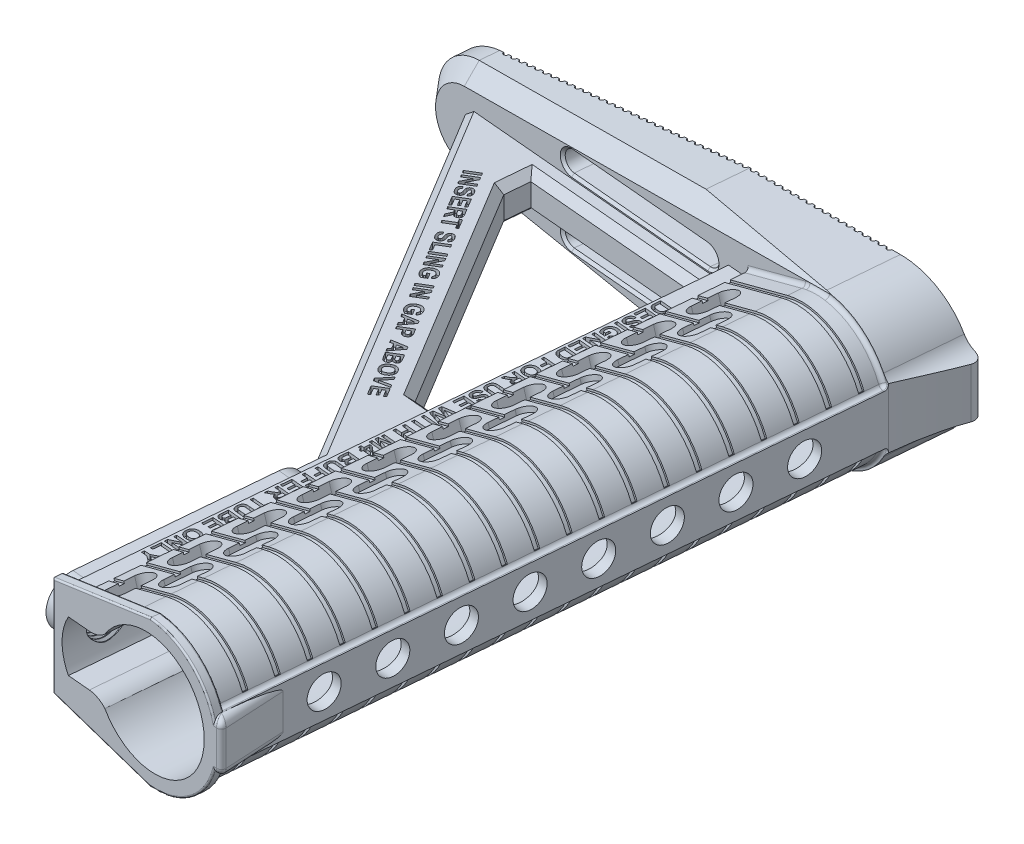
SolidWorks part; units mm, degrees
ref_plane "Front Plane" through (0, 0, 0) normal (0, 0, 1) x (1, 0, 0)
ref_plane "Top Plane" through (0, 0, 0) normal (0, 1, 0) x (1, 0, 0)
ref_plane "Right Plane" through (0, 0, 0) normal (1, 0, 0) x (0, 0, -1)
sketch "Sketch1" plane through (0, 0, 0) normal (0, 0, 1) x (1, 0, 0)
  line L0 (0, -22.912) -> (0, -13.514) construction
  line L1 (-6.477, -13.514) -> (6.477, -13.514) construction
  line L2 (-6.477, -17.0497) -> (-6.477, -22.912)
  line L3 (-6.477, -22.912) -> (6.477, -22.912) construction
  line L4 (6.477, -17.0497) -> (6.477, -22.912)
  line L5 (14.986, 0) -> (-14.986, 0) construction
  line L6 (-14.986, 0) -> (-17.526, 0) construction
  line L8 (14.986, 0) -> (17.526, 0) construction
  line L9 (-16.6556, -5.4546) -> (-9.525, -27.2278)
  line L10 (16.6556, -5.4546) -> (9.525, -27.2278)
  line L11 (-9.525, -27.2278) -> (9.525, -27.2278)
  line L12 (-6.35, 17.526) -> (6.35, 17.526)
  line L13 (-6.35, 17.526) -> (-6.35, 17.1821)
  line L14 (6.35, 17.526) -> (6.35, 17.1821)
  line L15 (16.6556, -5.4546) -> (-16.6556, -5.4546) construction
  arc A0 (9.0094, -11.9754) -> (-9.0094, -11.9754) centre (0, 0) ccw
  arc A1 (9.0094, -11.9754) -> (6.477, -17.0497) centre (12.827, -17.0497) ccw
  arc A2 (-9.0094, -11.9754) -> (-6.477, -17.0497) centre (-12.827, -17.0497) cw
  arc A3 (-6.477, -22.912) -> (6.477, -22.912) centre (0, -11.9878) ccw
  arc A4 (-17.526, 0) -> (-7.1051, 16.0212) centre (0, 0) cw
  arc A5 (-17.526, 0) -> (-16.6556, -5.4546) centre (0, 0) ccw
  arc A6 (17.526, 0) -> (16.6556, -5.4546) centre (0, 0) cw
  arc A7 (7.1051, 16.0212) -> (17.526, 0) centre (0, 0) cw
  arc A8 (6.35, 17.1821) -> (7.1051, 16.0212) centre (7.62, 17.1821) ccw
  arc A9 (-6.35, 17.1821) -> (-7.1051, 16.0212) centre (-7.62, 17.1821) cw
  point P8 (0, -13.514)
  point P19 (0, 0)
  point P26 (0, -27.2278)
  point P32 (0, 17.526)
  point P39 (6.35, 16.3352)
  dimension "D1" = 29.972
  dimension "D4" = 6.35
  dimension "D5" = 12.7
  dimension "D9" = 1.27
  dimension "D10" = 15.24
  dimension "D2" = 12.954
  dimension "D3" = 9.398
  dimension "D6" = 2.54
  dimension "D7" = 19.05
  dimension "D8" = 12.7
extrude "Boss-Extrude1" add sketch "Sketch1" along normal blind 177.8
sketch "Sketch2" plane through (0, 0, 177.8) normal (0, 0, 1) x (1, 0, 0)
  line L0 (-6.35, 17.526) -> (6.35, 17.526)
  line L1 (18.6409, 0) -> (-18.6409, 0) construction
  line L2 (-18.6409, 0) -> (-18.6409, -38.1)
  line L3 (-18.6409, -38.1) -> (18.6409, -38.1) construction
  line L4 (18.6409, -38.1) -> (18.6409, 0)
  line L5 (0, -38.1) -> (0, -101.6) construction
  line L6 (-12.6437, -101.6) -> (12.6437, -101.6) construction
  line L7 (-12.6437, -101.6) -> (-18.6409, -38.1)
  line L8 (12.6437, -101.6) -> (18.6409, -38.1)
  line L9 (6.477, -22.912) -> (6.477, -17.0497) construction
  line L10 (-6.477, -17.0497) -> (-6.477, -22.912) construction
  line L11 (6.477, -22.912) -> (6.477, -17.0497)
  line L12 (-6.477, -17.0497) -> (-6.477, -22.912)
  arc A0 (-6.35, 17.526) -> (-18.6409, 0) centre (0, 0) ccw
  arc A1 (18.6409, 0) -> (6.35, 17.526) centre (0, 0) ccw
  arc A2 (-12.6437, -101.6) -> (12.6437, -101.6) centre (0, -100.4059) ccw
  arc A3 (9.0094, -11.9754) -> (6.477, -17.0497) centre (12.827, -17.0497) ccw construction
  arc A4 (-6.477, -22.912) -> (6.477, -22.912) centre (0, -11.9878) ccw construction
  arc A5 (-6.477, -17.0497) -> (-9.0094, -11.9754) centre (-12.827, -17.0497) ccw construction
  arc A6 (9.0094, -11.9754) -> (-9.0094, -11.9754) centre (0, 0) ccw construction
  arc A7 (9.0094, -11.9754) -> (6.477, -17.0497) centre (12.827, -17.0497) ccw
  arc A8 (-6.477, -22.912) -> (6.477, -22.912) centre (0, -11.9878) ccw
  arc A9 (-6.477, -17.0497) -> (-9.0094, -11.9754) centre (-12.827, -17.0497) ccw
  arc A10 (9.0094, -11.9754) -> (-9.0094, -11.9754) centre (0, 0) ccw
  point P9 (0, 0)
  point P16 (0, -101.6)
  dimension "D3" = 12.7
  dimension "D1" = 38.1
  dimension "D2" = 63.5
extrude "Boss-Extrude2" add sketch "Sketch2" against normal blind 19.05
sketch "Sketch3" plane through (0, 0, 0) normal (1, 0, 0) x (0, 0, -1)
  line L0 (-177.8, 17.526) -> (-166.3712, -113.1059)
  line L1 (-177.8, -113.1059) -> (-158.75, -113.1059) construction
  line L2 (-166.3712, -113.1059) -> (-177.8, -113.1059)
  line L3 (-177.8, -113.1059) -> (-177.8, 17.526)
  dimension "D1" = 5
extrude "Cut-Extrude1" cut sketch "Sketch3" against normal through all both and the other way through all
sketch "Sketch4" plane through (0, -27.2278, 0) normal (0, -1, 0) x (1, 0, 0)
  line L0 (0, 0) -> (0, 58.42) construction
  circle A0 centre (0, 58.42) radius 4.0005
  circle A1 centre (0, 42.291) radius 4.0005
  circle A2 centre (0, 26.162) radius 4.0005
  circle A3 centre (0, 10.033) radius 4.0005
  dimension "D2" = 8.001
  dimension "D3" = 16.129
  dimension "D4" = 16.129
  dimension "D5" = 16.129
  dimension "D1" = 58.42
extrude "Cut-Extrude2" cut sketch "Sketch4" against normal through all both and the other way through all
sketch "Sketch5" plane through (0, -27.2278, 0) normal (0, -1, 0) x (1, 0, 0)
  line L0 (0, 42.291) -> (0, 58.42) construction
  line L3 (0, 58.42) -> (0, 74.549) construction
  line L4 (0, 74.549) -> (0, 90.678) construction
  line L5 (0, 90.678) -> (0, 106.807) construction
  line L6 (0, 106.807) -> (0, 122.936) construction
  line L7 (0, 122.936) -> (0, 139.065) construction
  circle A2 centre (0, 58.42) radius 4.0005 construction
  circle A3 centre (0, 42.291) radius 4.0005 construction
  circle A4 centre (0, 26.162) radius 4.0005 construction
  circle A5 centre (0, 10.033) radius 4.0005 construction
  circle A6 centre (0, 58.42) radius 4.0005 construction
  circle A7 centre (0, 42.291) radius 4.0005 construction
  circle A8 centre (0, 26.162) radius 4.0005 construction
  circle A9 centre (0, 10.033) radius 4.0005 construction
  circle A10 centre (0, 74.549) radius 4.0005
  circle A11 centre (0, 90.678) radius 4.0005
  circle A12 centre (0, 106.807) radius 4.0005
  circle A13 centre (0, 122.936) radius 4.0005
  circle A14 centre (0, 139.065) radius 4.0005
extrude "Cut-Extrude3" cut sketch "Sketch5" against normal through all both and the other way through all
sketch "Sketch6" plane through (-16.6556, -5.4546, 0) normal (-0.9503, -0.3112, 0) x (0, 0, 1)
  line L0 (0, -11.4555) -> (8.89, -11.4555) construction
  line L3 (5.715, -11.4555) -> (12.065, -11.4555) construction
  line L4 (5.715, -8.9155) -> (12.065, -8.9155)
  line L5 (5.715, -13.9955) -> (12.065, -13.9955)
  line L6 (0, 0) -> (0, -22.9111) construction
  line L7 (20.955, -13.9955) -> (27.305, -13.9955)
  line L8 (20.955, -8.9155) -> (27.305, -8.9155)
  line L9 (20.955, -11.4555) -> (27.305, -11.4555) construction
  line L10 (36.195, -13.9955) -> (42.545, -13.9955)
  line L11 (36.195, -8.9155) -> (42.545, -8.9155)
  line L12 (36.195, -11.4555) -> (42.545, -11.4555) construction
  line L13 (51.435, -13.9955) -> (57.785, -13.9955)
  line L14 (51.435, -8.9155) -> (57.785, -8.9155)
  line L15 (51.435, -11.4555) -> (57.785, -11.4555) construction
  line L16 (66.675, -13.9955) -> (73.025, -13.9955)
  line L17 (66.675, -8.9155) -> (73.025, -8.9155)
  line L18 (66.675, -11.4555) -> (73.025, -11.4555) construction
  line L19 (81.915, -13.9955) -> (88.265, -13.9955)
  line L20 (81.915, -8.9155) -> (88.265, -8.9155)
  line L21 (81.915, -11.4555) -> (88.265, -11.4555) construction
  line L22 (97.155, -13.9955) -> (103.505, -13.9955)
  line L23 (97.155, -8.9155) -> (103.505, -8.9155)
  line L24 (97.155, -11.4555) -> (103.505, -11.4555) construction
  line L25 (112.395, -13.9955) -> (118.745, -13.9955)
  line L26 (112.395, -8.9155) -> (118.745, -8.9155)
  line L27 (112.395, -11.4555) -> (118.745, -11.4555) construction
  line L28 (127.635, -13.9955) -> (133.985, -13.9955)
  line L29 (127.635, -8.9155) -> (133.985, -8.9155)
  line L30 (127.635, -11.4555) -> (133.985, -11.4555) construction
  line L31 (142.875, -13.9955) -> (149.225, -13.9955)
  line L32 (142.875, -8.9155) -> (149.225, -8.9155)
  line L33 (142.875, -11.4555) -> (149.225, -11.4555) construction
  arc A0 (5.715, -8.9155) -> (5.715, -13.9955) centre (5.715, -11.4555) ccw
  arc A1 (12.065, -13.9955) -> (12.065, -8.9155) centre (12.065, -11.4555) ccw
  arc A2 (20.955, -8.9155) -> (20.955, -13.9955) centre (20.955, -11.4555) ccw
  arc A3 (27.305, -13.9955) -> (27.305, -8.9155) centre (27.305, -11.4555) ccw
  arc A4 (36.195, -8.9155) -> (36.195, -13.9955) centre (36.195, -11.4555) ccw
  arc A5 (42.545, -13.9955) -> (42.545, -8.9155) centre (42.545, -11.4555) ccw
  arc A6 (51.435, -8.9155) -> (51.435, -13.9955) centre (51.435, -11.4555) ccw
  arc A7 (57.785, -13.9955) -> (57.785, -8.9155) centre (57.785, -11.4555) ccw
  arc A8 (66.675, -8.9155) -> (66.675, -13.9955) centre (66.675, -11.4555) ccw
  arc A9 (73.025, -13.9955) -> (73.025, -8.9155) centre (73.025, -11.4555) ccw
  arc A10 (81.915, -8.9155) -> (81.915, -13.9955) centre (81.915, -11.4555) ccw
  arc A11 (88.265, -13.9955) -> (88.265, -8.9155) centre (88.265, -11.4555) ccw
  arc A12 (97.155, -8.9155) -> (97.155, -13.9955) centre (97.155, -11.4555) ccw
  arc A13 (103.505, -13.9955) -> (103.505, -8.9155) centre (103.505, -11.4555) ccw
  arc A14 (112.395, -8.9155) -> (112.395, -13.9955) centre (112.395, -11.4555) ccw
  arc A15 (118.745, -13.9955) -> (118.745, -8.9155) centre (118.745, -11.4555) ccw
  arc A16 (127.635, -8.9155) -> (127.635, -13.9955) centre (127.635, -11.4555) ccw
  arc A17 (133.985, -13.9955) -> (133.985, -8.9155) centre (133.985, -11.4555) ccw
  arc A18 (142.875, -8.9155) -> (142.875, -13.9955) centre (142.875, -11.4555) ccw
  arc A19 (149.225, -13.9955) -> (149.225, -8.9155) centre (149.225, -11.4555) ccw
  point P8 (8.89, -11.4555)
  point P15 (24.13, -11.4555)
  point P22 (39.37, -11.4555)
  point P29 (54.61, -11.4555)
  point P36 (69.85, -11.4555)
  point P43 (85.09, -11.4555)
  point P50 (100.33, -11.4555)
  point P57 (115.57, -11.4555)
  point P64 (130.81, -11.4555)
  point P71 (146.05, -11.4555)
  dimension "D1" = 6.35
  dimension "D2" = 5.08
  dimension "D3" = 8.89
  dimension "D4" = 10
extrude "Cut-Extrude4" cut sketch "Sketch6" against normal blind 3.81
mirror "Mirror1" about plane through (0, 0, 0) normal (1, 0, 0) of "Cut-Extrude4"
sketch "Sketch7" plane through (0, 0, 0) normal (1, 0, 0) x (0, 0, -1)
  line L0 (-177.8, 17.526) -> (-177.6174, 15.4385) construction
  line L4 (-177.8, 17.526) -> (-176.2667, 0) construction
  line L5 (-166.4597, -112.0937) -> (-166.3712, -113.1059) construction
  circle A101 centre (-177.6174, 15.4385) radius 0.635
  circle A102 centre (-177.4403, 13.4142) radius 0.635
  circle A103 centre (-177.2632, 11.3898) radius 0.635
  circle A104 centre (-177.086, 9.3655) radius 0.635
  circle A105 centre (-176.9089, 7.3412) radius 0.635
  circle A106 centre (-176.7318, 5.3169) radius 0.635
  circle A107 centre (-176.5547, 3.2925) radius 0.635
  circle A108 centre (-176.3776, 1.2682) radius 0.635
  circle A109 centre (-176.2005, -0.7561) radius 0.635
  circle A110 centre (-176.0234, -2.7804) radius 0.635
  circle A111 centre (-175.8463, -4.8047) radius 0.635
  circle A112 centre (-175.6692, -6.8291) radius 0.635
  circle A113 centre (-175.4921, -8.8534) radius 0.635
  circle A114 centre (-175.315, -10.8777) radius 0.635
  circle A115 centre (-175.1379, -12.902) radius 0.635
  circle A116 centre (-174.9608, -14.9263) radius 0.635
  circle A117 centre (-174.7837, -16.9507) radius 0.635
  circle A118 centre (-174.6066, -18.975) radius 0.635
  circle A119 centre (-174.4295, -20.9993) radius 0.635
  circle A120 centre (-174.2524, -23.0236) radius 0.635
  circle A121 centre (-174.0753, -25.0479) radius 0.635
  circle A122 centre (-173.8982, -27.0723) radius 0.635
  circle A123 centre (-173.7211, -29.0966) radius 0.635
  circle A124 centre (-173.5439, -31.1209) radius 0.635
  circle A125 centre (-173.3668, -33.1452) radius 0.635
  circle A126 centre (-173.1897, -35.1696) radius 0.635
  circle A127 centre (-173.0126, -37.1939) radius 0.635
  circle A128 centre (-172.8355, -39.2182) radius 0.635
  circle A129 centre (-172.6584, -41.2425) radius 0.635
  circle A130 centre (-172.4813, -43.2668) radius 0.635
  circle A131 centre (-172.3042, -45.2912) radius 0.635
  circle A132 centre (-172.1271, -47.3155) radius 0.635
  circle A133 centre (-171.95, -49.3398) radius 0.635
  circle A134 centre (-171.7729, -51.3641) radius 0.635
  circle A135 centre (-171.5958, -53.3884) radius 0.635
  circle A136 centre (-171.4187, -55.4128) radius 0.635
  circle A137 centre (-171.2416, -57.4371) radius 0.635
  circle A138 centre (-171.0645, -59.4614) radius 0.635
  circle A139 centre (-170.8874, -61.4857) radius 0.635
  circle A140 centre (-170.7103, -63.51) radius 0.635
  circle A141 centre (-170.5332, -65.5344) radius 0.635
  circle A142 centre (-170.3561, -67.5587) radius 0.635
  circle A143 centre (-170.1789, -69.583) radius 0.635
  circle A144 centre (-170.0018, -71.6073) radius 0.635
  circle A145 centre (-169.8247, -73.6316) radius 0.635
  circle A146 centre (-169.6476, -75.656) radius 0.635
  circle A147 centre (-169.4705, -77.6803) radius 0.635
  circle A148 centre (-169.2934, -79.7046) radius 0.635
  circle A149 centre (-169.1163, -81.7289) radius 0.635
  circle A150 centre (-168.9392, -83.7533) radius 0.635
  circle A151 centre (-168.7621, -85.7776) radius 0.635
  circle A152 centre (-168.585, -87.8019) radius 0.635
  circle A153 centre (-168.4079, -89.8262) radius 0.635
  circle A154 centre (-168.2308, -91.8505) radius 0.635
  circle A155 centre (-168.0537, -93.8749) radius 0.635
  circle A156 centre (-167.8766, -95.8992) radius 0.635
  circle A157 centre (-167.6995, -97.9235) radius 0.635
  circle A158 centre (-167.5224, -99.9478) radius 0.635
  circle A159 centre (-167.3453, -101.9721) radius 0.635
  circle A160 centre (-167.1682, -103.9965) radius 0.635
  circle A161 centre (-166.9911, -106.0208) radius 0.635
  circle A162 centre (-166.814, -108.0451) radius 0.635
  circle A163 centre (-166.6368, -110.0694) radius 0.635
  circle A164 centre (-166.4597, -112.0937) radius 0.635
  dimension "D1" = 2.0955
  dimension "D2" = 1.27
  dimension "D3" = 1.016
extrude "Cut-Extrude5" cut sketch "Sketch7" against normal through all both and the other way through all
sketch "Sketch11" plane through (0, -27.2278, 0) normal (0, -1, 0) x (1, 0, 0)
  line L0 (0, 10.033) -> (0, 58.42) construction
  line L1 (-6.35, 10.033) -> (-6.35, 58.42)
  line L2 (6.35, 10.033) -> (6.35, 58.42)
  arc A0 (-6.35, 10.033) -> (6.35, 10.033) centre (0, 10.033) ccw
  arc A1 (6.35, 58.42) -> (-6.35, 58.42) centre (0, 58.42) ccw
  circle A4 centre (0, 58.42) radius 4.0005 construction
  circle A5 centre (0, 42.291) radius 4.0005 construction
  circle A6 centre (0, 26.162) radius 4.0005 construction
  circle A7 centre (0, 10.033) radius 4.0005 construction
  circle A8 centre (0, 58.42) radius 4.0005
  circle A9 centre (0, 42.291) radius 4.0005
  circle A10 centre (0, 26.162) radius 4.0005
  circle A11 centre (0, 10.033) radius 4.0005
  point P4 (0, 34.2265)
  dimension "D1" = 6.35
extrude "Boss-Extrude3" add sketch "Sketch11" along normal blind 6.35
sketch "Sketch12" plane through (0, 0, 0) normal (1, 0, 0) x (0, 0, -1)
  line L1 (-66.4845, -33.5778) -> (-158.75, -100.8878)
  line L2 (-158.75, -100.8878) -> (-158.75, -27.2278)
  line L4 (-62.4205, -27.2278) -> (-158.75, -27.2278)
  line L6 (-154.2599, -31.7179) -> (-154.2599, -77.2593)
  line L8 (-94.1881, -31.7179) -> (-154.2599, -31.7179)
  line L9 (-158.75, -27.2278) -> (-154.2599, -31.7179) construction
  line L10 (-94.1881, -31.7179) -> (-94.1881, -38.0679)
  line L11 (-94.1881, -38.0679) -> (-147.9099, -77.2593)
  line L12 (-147.9099, -77.2593) -> (-154.2599, -77.2593)
  line L13 (-121.049, -57.6636) -> (-113.5641, -67.9236) construction
  line L14 (-158.75, -27.2278) -> (0, -27.2278) construction
  line L15 (-64.77, -33.5778) -> (-58.42, -33.5778) construction
  line L16 (-62.4205, -27.2278) -> (-62.4205, -33.5778)
  line L17 (-62.4205, -33.5778) -> (-54.4195, -33.5778) construction
  line L18 (-62.4205, -33.5778) -> (-66.4845, -33.5778)
  line L19 (-46.2915, -33.5778) -> (-38.2905, -33.5778) construction
  line L20 (-62.4205, -33.5778) -> (-54.4195, -33.5778) construction
  line L21 (-46.2915, -33.5778) -> (-38.2905, -33.5778) construction
  line L22 (-158.75, 0) -> (-158.75, -38.1) construction
  line L23 (-158.75, -27.2278) -> (0, -27.2278) construction
  dimension "D1" = 45
  dimension "D2" = 6.35
  dimension "D3" = 6.35
  dimension "D4" = 12.7
  dimension "D5" = 4.064
  dimension "D6" = 73.66
extrude "Boss-Extrude5" add sketch "Sketch12" along normal mid plane 9.525
chamfer "Chamfer1" distance 1.905 angle 45 12 edges at (-4.7625, -54.4886, 154.2599) (-4.7625, -77.2593, 151.0849) (-4.7625, -57.6636, 121.049) (-4.7625, -31.7179, 124.224) (-4.7625, -34.8929, 94.1881) (4.7625, -34.8929, 94.1881) (4.7625, -31.7179, 124.224) (4.7625, -54.4886, 154.2599) (4.7625, -77.2593, 151.0849) (4.7625, -57.6636, 121.049) (-4.7625, -67.2328, 112.6172) (4.7625, -67.2328, 112.6172)
chamfer "Chamfer2" distance 3.81 angle 45
sketch "Sketch14" plane through (0, 0, 0) normal (0, 0, -1) x (-1, 0, 0)
  line L0 (-9.525, -27.2278) -> (-9.525, -20.8778)
  line L1 (-9.525, -20.8778) -> (-11.4031, -21.4929)
  line L2 (-9.525, -27.2278) -> (-16.6556, -5.4546) construction
  line L3 (-9.525, -27.2278) -> (-16.6556, -5.4546) construction
  line L4 (0, 17.526) -> (0, -27.2278) construction
  line L5 (-6.35, 17.526) -> (6.35, 17.526) construction
  line L6 (-6.35, -27.2278) -> (6.35, -27.2278) construction
  line L7 (-9.525, -27.2278) -> (-11.4031, -21.4929)
  line L8 (9.525, -27.2278) -> (9.525, -20.8778)
  line L9 (9.525, -20.8778) -> (11.4031, -21.4929)
  line L10 (9.525, -27.2278) -> (11.4031, -21.4929)
  dimension "D1" = 6.35
extrude "Cut-Extrude7" cut sketch "Sketch14" against normal up to surface (158.75 mm away)
sketch "Sketch15" plane through (0, 0, 0) normal (0, 0, -1) x (-1, 0, 0)
  line L0 (-12.7, -27.2278) -> (12.7, -27.2278)
  line L2 (-6.35, 17.526) -> (6.35, 17.526)
  line L3 (18.6409, 0) -> (-18.6409, 0) construction
  line L4 (-12.7, -27.2278) -> (-18.6409, 0)
  line L5 (12.7, -27.2278) -> (18.6409, 0)
  line L6 (-6.35, -27.2278) -> (6.35, -27.2278) construction
  line L7 (6.477, -17.0497) -> (6.477, -22.912) construction
  line L8 (-6.477, -22.912) -> (-6.477, -17.0497) construction
  line L9 (6.477, -17.0497) -> (6.477, -22.912)
  line L10 (-6.477, -22.912) -> (-6.477, -17.0497)
  arc A0 (-6.35, 17.526) -> (-18.6409, 0) centre (0, 0) ccw
  arc A1 (18.6409, 0) -> (6.35, 17.526) centre (0, 0) ccw
  arc A2 (9.0094, -11.9754) -> (6.477, -17.0497) centre (12.827, -17.0497) ccw construction
  arc A3 (-6.477, -22.912) -> (6.477, -22.912) centre (0, -11.9878) ccw construction
  arc A4 (-6.477, -17.0497) -> (-9.0094, -11.9754) centre (-12.827, -17.0497) ccw construction
  arc A5 (9.0094, -11.9754) -> (-9.0094, -11.9754) centre (0, 0) ccw construction
  arc A6 (9.0094, -11.9754) -> (6.477, -17.0497) centre (12.827, -17.0497) ccw
  arc A7 (-6.477, -22.912) -> (6.477, -22.912) centre (0, -11.9878) ccw
  arc A8 (-6.477, -17.0497) -> (-9.0094, -11.9754) centre (-12.827, -17.0497) ccw
  arc A9 (9.0094, -11.9754) -> (-9.0094, -11.9754) centre (0, 0) ccw
  point P3 (0, -27.2278)
  point P14 (0, 0)
  dimension "D1" = 25.4
extrude "Boss-Extrude6" add sketch "Sketch15" against normal blind 2.54
fillet "Fillet2" radius 0.4064 13 edges at (0, -27.2278, 0) (-11.1125, -27.2278, 2.54) (11.1125, -27.2278, 2.54) (-6.35, 17.3541, 2.54) (6.35, 17.3541, 2.54) (-15.6705, -13.6139, 0) (-15.2619, 10.7031, 0) (15.2619, 10.7031, 0) (15.6705, -13.6139, 0) (-15.6705, -13.6139, 2.54) (15.6705, -13.6139, 2.54) (15.2619, 10.7031, 2.54) (-15.2619, 10.7031, 2.54)
fillet "Fillet3" radius 1.016
thread "Thread1" pitch 1.27 start angle 0, offset 1.27, length 0, pitch 1.27, diameter 8.001
ref_plane "Plane1" through (4.0005, -34.8478, 10.033) normal (0, 0, -1) x (-1, 0, 0)
sketch "Thread Profile1" plane through (4.0005, -34.8478, 10.033) normal (0, 0, -1) x (-1, 0, 0)
  line L0 (0, 0) -> (0, 1.27) construction
  line L11 (0, 0) -> (0, 1.1112)
  line L12 (0, 1.1112) -> (-0.6874, 0.7144)
  line L13 (-0.6874, 0.7144) -> (-0.6874, 0.3969)
  line L15 (-0.6874, 0.3969) -> (0, 0)
  line L17 (-0.6874, 0.5556) -> (0, 0.5556) construction
  point P2 (0, 0)
  dimension "Pitch" = 1.27
  dimension "Profile_Angle" = 60
  dimension "Profile_Land" = 0.3175
  dimension "Profile_Height" = 0.6874
thread "Thread2" pitch 1.27 start angle 0, offset 1.27, length 0, pitch 1.27, diameter 8.001
ref_plane "Plane2" through (4.0005, -34.8478, 26.162) normal (0, 0, -1) x (-1, 0, 0)
sketch "Thread Profile2" plane through (4.0005, -34.8478, 26.162) normal (0, 0, -1) x (-1, 0, 0)
  line L0 (0, 0) -> (0, 1.27) construction
  line L11 (0, 0) -> (0, 1.1112)
  line L12 (0, 1.1112) -> (-0.6874, 0.7144)
  line L13 (-0.6874, 0.7144) -> (-0.6874, 0.3969)
  line L15 (-0.6874, 0.3969) -> (0, 0)
  line L17 (-0.6874, 0.5556) -> (0, 0.5556) construction
  point P2 (0, 0)
  dimension "Pitch" = 1.27
  dimension "Profile_Angle" = 60
  dimension "Profile_Land" = 0.3175
  dimension "Profile_Height" = 0.6874
thread "Thread3" pitch 1.27 start angle 0, offset 1.27, length 0, pitch 1.27, diameter 8.001
ref_plane "Plane3" through (4.0005, -34.8478, 42.291) normal (0, 0, -1) x (-1, 0, 0)
sketch "Thread Profile3" plane through (4.0005, -34.8478, 42.291) normal (0, 0, -1) x (-1, 0, 0)
  line L0 (0, 0) -> (0, 1.27) construction
  line L11 (0, 0) -> (0, 1.1112)
  line L12 (0, 1.1112) -> (-0.6874, 0.7144)
  line L13 (-0.6874, 0.7144) -> (-0.6874, 0.3969)
  line L15 (-0.6874, 0.3969) -> (0, 0)
  line L17 (-0.6874, 0.5556) -> (0, 0.5556) construction
  point P2 (0, 0)
  dimension "Pitch" = 1.27
  dimension "Profile_Angle" = 60
  dimension "Profile_Land" = 0.3175
  dimension "Profile_Height" = 0.6874
thread "Thread4" pitch 1.27 start angle 0, offset 1.27, length 0, pitch 1.27, diameter 8.001
ref_plane "Plane4" through (4.0005, -34.8478, 58.42) normal (0, 0, -1) x (-1, 0, 0)
sketch "Thread Profile4" plane through (4.0005, -34.8478, 58.42) normal (0, 0, -1) x (-1, 0, 0)
  line L0 (0, 0) -> (0, 1.27) construction
  line L11 (0, 0) -> (0, 1.1112)
  line L12 (0, 1.1112) -> (-0.6874, 0.7144)
  line L13 (-0.6874, 0.7144) -> (-0.6874, 0.3969)
  line L15 (-0.6874, 0.3969) -> (0, 0)
  line L17 (-0.6874, 0.5556) -> (0, 0.5556) construction
  point P2 (0, 0)
  dimension "Pitch" = 1.27
  dimension "Profile_Angle" = 60
  dimension "Profile_Land" = 0.3175
  dimension "Profile_Height" = 0.6874
sketch "Sketch26" plane through (-9.525, 0, 0) normal (-1, 0, 0) x (0, 0, 1)
  line L0 (80.4418, -27.2278) -> (80.4418, -26.5928) construction
  line L1 (158.75, -27.2278) -> (2.1336, -27.2278) construction
  line L2 (80.4418, -26.5928) -> (80.4418, -21.5128) construction
  line L3 (80.4418, -21.5128) -> (80.4418, -20.8778) construction
  line L4 (158.75, -20.8778) -> (2.54, -20.8778) construction
  line L5 (158.3436, -26.5928) -> (2.54, -26.5928) construction
  line L6 (2.54, -26.8214) -> (2.54, -20.8778) construction
  text T0 "<b>  ANDERSON FIREARMS</b>" font "Arial" height in points 16
  text T1 "<b>AR-15 / M4 STANDARD STOCK     </b>" font "Arial" height in points 14
  point P13 (80.4418, -26.5928)
  dimension "D1" = 0.635
extrude "Cut-Extrude8" cut sketch "Sketch26" against normal blind 1.27
sketch "Sketch27" plane through (9.525, 0, 0) normal (1, 0, 0) x (0, 0, -1)
  line L0 (-80.4418, -27.2278) -> (-80.4418, -26.5928) construction
  line L1 (-158.75, -27.2278) -> (-2.1336, -27.2278) construction
  line L2 (-80.4418, -26.5928) -> (-80.4418, -21.5128) construction
  line L3 (-80.4418, -21.5128) -> (-80.4418, -20.8778) construction
  line L4 (-158.75, -20.8778) -> (-2.54, -20.8778) construction
  line L5 (-2.1336, -26.5928) -> (-158.75, -26.5928) construction
  line L6 (-158.75, -27.2278) -> (-158.75, -20.8778) construction
  text T0 "<b>DESIGNED FOR USE WITH M4 BUFFER TUBE ONLY</b>" font "Arial" height in points 14
  point P13 (-80.4418, -26.5928)
  dimension "D1" = 0.635
extrude "Cut-Extrude9" cut sketch "Sketch27" against normal blind 1.27
sketch "Sketch28" plane through (-4.7625, 0, 0) normal (-1, 0, 0) x (0, 0, 1)
  line L0 (119.786, -59.1003) -> (118.289, -61.1523) construction
  line L1 (147.2888, -79.1643) -> (92.2831, -39.0362) construction
  line L2 (118.289, -61.1523) -> (116.0435, -64.2302) construction
  line L3 (116.0435, -64.2302) -> (114.5466, -66.2822) construction
  line L5 (69.7168, -33.5778) -> (158.75, -98.5297) construction
  line L6 (73.3371, -33.0748) -> (158.75, -95.3857) construction
  line L7 (158.75, -27.2278) -> (158.75, -98.5297) construction
  text T0 "<b>INSERT SLING IN GAP ABOVE</b>" font "Arial" height in points 14
  point P15 (116.0435, -64.2302)
  dimension "D1" = 2.54
extrude "Cut-Extrude10" cut sketch "Sketch28" against normal blind 1.27
sketch "Sketch29" plane through (4.7625, 0, 0) normal (1, 0, 0) x (0, 0, -1)
  line L0 (-119.786, -59.1003) -> (-118.289, -61.1523) construction
  line L1 (-92.2831, -39.0362) -> (-147.2888, -79.1643) construction
  line L2 (-118.289, -61.1523) -> (-116.0435, -64.2302) construction
  line L3 (-116.0435, -64.2302) -> (-114.5466, -66.2822) construction
  line L4 (-158.75, -98.5297) -> (-69.7168, -33.5778) construction
  line L5 (-73.3371, -33.0748) -> (-158.75, -95.3857) construction
  line L6 (-158.75, -27.2278) -> (-158.75, -98.5297) construction
  text T0 "<b>INSERT SLING IN GAP ABOVE</b>" font "Arial" height in points 14
  point P13 (-116.0435, -64.2302)
  dimension "D1" = 2.54
extrude "Cut-Extrude11" cut sketch "Sketch29" against normal blind 1.27
sketch "Sketch31" plane through (-16.6556, -5.4546, 0) normal (-0.9503, -0.3112, 0) x (0, 0, 1)
  line L0 (12.065, -8.9155) -> (20.955, -8.9155) construction
  line L1 (16.51, -8.9155) -> (16.51, 0) construction
  line L2 (157.734, 0) -> (2.54, 0) construction
  line L3 (13.335, -4.4578) -> (19.685, -4.4578) construction
  line L4 (13.335, -1.9178) -> (19.685, -1.9178)
  line L5 (13.335, -6.9978) -> (19.685, -6.9978)
  line L6 (5.715, -11.4555) -> (12.065, -11.4555) construction
  line L7 (12.065, -8.9155) -> (12.065, -13.9955) construction
  line L8 (19.685, -1.9178) -> (19.685, -6.9978) construction
  line L9 (27.305, -8.9155) -> (36.195, -8.9155) construction
  line L10 (31.75, -8.9155) -> (31.75, 0) construction
  line L11 (31.75, -4.4578) -> (16.51, -4.4578) construction
  line L12 (28.575, -6.9978) -> (34.925, -6.9978)
  line L13 (28.575, -1.9178) -> (34.925, -1.9178)
  line L14 (28.575, -4.4578) -> (34.925, -4.4578) construction
  line L15 (43.815, -6.9978) -> (50.165, -6.9978)
  line L16 (43.815, -1.9178) -> (50.165, -1.9178)
  line L17 (43.815, -4.4578) -> (50.165, -4.4578) construction
  line L18 (59.055, -6.9978) -> (65.405, -6.9978)
  line L19 (59.055, -1.9178) -> (65.405, -1.9178)
  line L20 (59.055, -4.4578) -> (65.405, -4.4578) construction
  line L21 (74.295, -6.9978) -> (80.645, -6.9978)
  line L22 (74.295, -1.9178) -> (80.645, -1.9178)
  line L23 (74.295, -4.4578) -> (80.645, -4.4578) construction
  line L24 (89.535, -6.9978) -> (95.885, -6.9978)
  line L25 (89.535, -1.9178) -> (95.885, -1.9178)
  line L26 (89.535, -4.4578) -> (95.885, -4.4578) construction
  line L27 (104.775, -6.9978) -> (111.125, -6.9978)
  line L28 (104.775, -1.9178) -> (111.125, -1.9178)
  line L29 (104.775, -4.4578) -> (111.125, -4.4578) construction
  line L30 (120.015, -6.9978) -> (126.365, -6.9978)
  line L31 (120.015, -1.9178) -> (126.365, -1.9178)
  line L32 (120.015, -4.4578) -> (126.365, -4.4578) construction
  line L33 (135.255, -6.9978) -> (141.605, -6.9978)
  line L34 (135.255, -1.9178) -> (141.605, -1.9178)
  line L35 (135.255, -4.4578) -> (141.605, -4.4578) construction
  arc A0 (13.335, -1.9178) -> (13.335, -6.9978) centre (13.335, -4.4578) ccw
  arc A1 (19.685, -6.9978) -> (19.685, -1.9178) centre (19.685, -4.4578) ccw
  arc A2 (28.575, -1.9178) -> (28.575, -6.9978) centre (28.575, -4.4578) ccw
  arc A3 (34.925, -6.9978) -> (34.925, -1.9178) centre (34.925, -4.4578) ccw
  arc A4 (43.815, -1.9178) -> (43.815, -6.9978) centre (43.815, -4.4578) ccw
  arc A5 (50.165, -6.9978) -> (50.165, -1.9178) centre (50.165, -4.4578) ccw
  arc A6 (59.055, -1.9178) -> (59.055, -6.9978) centre (59.055, -4.4578) ccw
  arc A7 (65.405, -6.9978) -> (65.405, -1.9178) centre (65.405, -4.4578) ccw
  arc A8 (74.295, -1.9178) -> (74.295, -6.9978) centre (74.295, -4.4578) ccw
  arc A9 (80.645, -6.9978) -> (80.645, -1.9178) centre (80.645, -4.4578) ccw
  arc A10 (89.535, -1.9178) -> (89.535, -6.9978) centre (89.535, -4.4578) ccw
  arc A11 (95.885, -6.9978) -> (95.885, -1.9178) centre (95.885, -4.4578) ccw
  arc A12 (104.775, -1.9178) -> (104.775, -6.9978) centre (104.775, -4.4578) ccw
  arc A13 (111.125, -6.9978) -> (111.125, -1.9178) centre (111.125, -4.4578) ccw
  arc A14 (120.015, -1.9178) -> (120.015, -6.9978) centre (120.015, -4.4578) ccw
  arc A15 (126.365, -6.9978) -> (126.365, -1.9178) centre (126.365, -4.4578) ccw
  arc A16 (135.255, -1.9178) -> (135.255, -6.9978) centre (135.255, -4.4578) ccw
  arc A17 (141.605, -6.9978) -> (141.605, -1.9178) centre (141.605, -4.4578) ccw
  point P10 (16.51, -4.4578)
  point P35 (31.75, -4.4578)
  point P42 (46.99, -4.4578)
  point P49 (62.23, -4.4578)
  point P56 (77.47, -4.4578)
  point P63 (92.71, -4.4578)
  point P70 (107.95, -4.4578)
  point P77 (123.19, -4.4578)
  point P84 (138.43, -4.4578)
  dimension "D1" = 9
extrude "Cut-Extrude13" cut sketch "Sketch31" against normal blind 1.27
mirror "Mirror2" about plane through (0, 0, 0) normal (1, 0, 0) of "Cut-Extrude13"
sketch "Sketch33" plane through (0, 0, 0) normal (0, 0, -1) x (-1, 0, 0)
  circle A0 centre (0, 0) radius 15.113
  dimension "D1" = 30.226
extrude "Cut-Extrude14" cut sketch "Sketch33" against normal through all both and the other way through all
sketch "Sketch35" plane through (0, 0, 158.75) normal (0, 0, -1) x (-1, 0, 0)
  line L0 (-8.255, -71.1959) -> (-8.255, -33.0959) construction
  line L1 (-10.795, -71.1959) -> (-10.795, -33.0959)
  line L2 (-5.715, -71.1959) -> (-5.715, -33.0959)
  line L3 (0, -109.2959) -> (0, -52.1459) construction
  line L4 (0, -52.1459) -> (-8.255, -52.1459) construction
  line L5 (8.255, -71.1959) -> (8.255, -33.0959) construction
  line L6 (10.795, -71.1959) -> (10.795, -33.0959)
  line L7 (5.715, -71.1959) -> (5.715, -33.0959)
  arc A0 (-10.795, -71.1959) -> (-5.715, -71.1959) centre (-8.255, -71.1959) ccw
  arc A1 (-5.715, -33.0959) -> (-10.795, -33.0959) centre (-8.255, -33.0959) ccw
  arc A2 (-8.8506, -101.2418) -> (8.8506, -101.2418) centre (0, -100.4059) ccw construction
  arc A3 (10.795, -71.1959) -> (5.715, -71.1959) centre (8.255, -71.1959) cw
  arc A4 (5.715, -33.0959) -> (10.795, -33.0959) centre (8.255, -33.0959) cw
  point P2 (-8.255, -52.1459)
  point P17 (8.255, -52.1459)
  dimension "D4" = 2.54
  dimension "D1" = 57.15
  dimension "D2" = 8.255
  dimension "D3" = 38.1
extrude "Cut-Extrude15" cut sketch "Sketch35" against normal blind 8.89
chamfer "Chamfer3" distance 0.635 angle 45 8 edges at (-10.795, -52.1459, 158.75) (-8.255, -30.5559, 158.75) (-8.255, -73.7359, 158.75) (-5.715, -52.1459, 158.75) (10.795, -52.1459, 158.75) (8.255, -73.7359, 158.75) (8.255, -30.5559, 158.75) (5.715, -52.1459, 158.75)
sketch "Sketch36" plane through (0, 0, 0) normal (1, 0, 0) x (0, 0, -1)
  line L0 (-176.112, -1.7683) -> (-177.8, 17.526)
  line L1 (-177.8, 17.526) -> (-176.53, 17.526)
  line L2 (-177.8, 17.526) -> (-157.734, 17.526) construction
  line L3 (-176.53, 17.526) -> (-174.842, -1.7683)
  line L4 (-174.842, -1.7683) -> (-176.112, -1.7683)
  line L5 (-167.4338, -100.96) -> (-166.3712, -113.1059)
  line L6 (-166.9357, -106.6534) -> (-166.8693, -107.4125) construction
  line L7 (-166.3712, -113.1059) -> (-165.1012, -113.1059)
  line L9 (-165.1012, -113.1059) -> (-166.1638, -100.96)
  line L10 (-166.1638, -100.96) -> (-167.4338, -100.96)
  line L11 (-176.1452, -1.3887) -> (-176.0788, -2.1478) construction
  line L12 (-167.467, -100.5804) -> (-167.4006, -101.3396) construction
  dimension "D1" = 1.27
  dimension "D2" = 1.27
extrude "Boss-Extrude8" add sketch "Sketch36" along normal mid plane 50.8
sketch "Sketch38" plane through (0, 0, 158.75) normal (0, 0, -1) x (-1, 0, 0)
  line L1 (-25.4, -1.7683) -> (-25.4, 17.526)
  line L2 (-25.4, 17.526) -> (-6.35, 17.526)
  line L4 (25.4, -1.7683) -> (25.4, 17.526)
  line L5 (25.4, 17.526) -> (6.35, 17.526)
  line L7 (-25.4, -100.96) -> (-25.4, -116.2)
  line L8 (-25.4, -116.2) -> (25.4, -116.2)
  line L9 (25.4, -116.2) -> (25.4, -100.96)
  line L11 (25.4, -1.7683) -> (25.4, 17.526) construction
  line L12 (-25.4, -1.7683) -> (-18.6409, -1.7683)
  line L13 (-18.6409, -1.7683) -> (-18.6409, 0)
  line L14 (25.4, -1.7683) -> (18.6409, -1.7683)
  line L15 (18.6409, -1.7683) -> (18.6409, 0)
  line L16 (-12.6437, -101.6) -> (-12.7042, -100.96)
  line L17 (-12.7042, -100.96) -> (-25.4, -100.96)
  line L18 (12.6437, -101.6) -> (12.7042, -100.96)
  line L19 (12.7042, -100.96) -> (25.4, -100.96)
  circle A0 centre (0, 0) radius 15.113
  arc A1 (-18.6409, 0) -> (-6.35, 17.526) centre (0, 0) cw
  arc A2 (18.6409, 0) -> (6.35, 17.526) centre (0, 0) ccw
  arc A3 (18.5679, 1.6481) -> (7.3736, 17.1206) centre (0, 0) ccw construction
  arc A4 (-6.35, 17.526) -> (-18.6409, 0) centre (0, 0) ccw construction
  arc A5 (-12.6437, -101.6) -> (12.6437, -101.6) centre (0, -100.4059) ccw
  arc A6 (-12.6437, -101.6) -> (12.6437, -101.6) centre (0, -100.4059) ccw construction
  arc A7 (15.0092, -1.7683) -> (-15.0092, -1.7683) centre (0, 0) ccw construction
  arc A8 (15.0092, -1.7683) -> (-15.0092, -1.7683) centre (0, 0) ccw construction
  dimension "D1" = 15.24
extrude "Cut-Extrude16" cut sketch "Sketch38" against normal through all
ref_plane "Plane5" through (0, 0, 8.89) normal (0, 0, -1) x (-1, 0, 0)
sketch "Sketch39" plane through (0, 0, 8.89) normal (0, 0, -1) x (-1, 0, 0)
  line L0 (-16.6556, -5.4546) -> (-11.4031, -21.4929) construction
  line L3 (11.4031, -21.4929) -> (16.6556, -5.4546) construction
  line L4 (-16.6556, -5.4546) -> (-11.4031, -21.4929)
  line L5 (10.9204, -21.3348) -> (16.1728, -5.2965)
  line L6 (-16.1728, -5.2965) -> (-10.9204, -21.3348)
  line L7 (11.4031, -21.4929) -> (16.6556, -5.4546)
  line L8 (6.8992, 15.5568) -> (7.1051, 16.0212)
  line L9 (-6.8992, 15.5568) -> (-7.1051, 16.0212)
  line L10 (-10.9204, -21.3348) -> (-11.4031, -21.4929)
  line L11 (10.9204, -21.3348) -> (11.4031, -21.4929)
  arc A0 (-7.1051, 16.0212) -> (-16.6556, -5.4546) centre (0, 0) ccw construction
  arc A3 (16.6556, -5.4546) -> (7.1051, 16.0212) centre (0, 0) ccw construction
  arc A4 (-7.1051, 16.0212) -> (-16.6556, -5.4546) centre (0, 0) ccw
  arc A5 (16.1728, -5.2965) -> (6.8992, 15.5568) centre (0, 0) ccw
  arc A6 (-6.8992, 15.5568) -> (-16.1728, -5.2965) centre (0, 0) ccw
  arc A7 (16.6556, -5.4546) -> (7.1051, 16.0212) centre (0, 0) ccw
  dimension "D1" = 0.508
extrude "Cut-Extrude17" cut sketch "Sketch39" against normal mid plane 1.27
pattern_linear "LPattern1" count 20 spacing 7.62 along (0, 0, 1) of "Cut-Extrude17"
sketch "Sketch41" plane through (0, 0, 0) normal (1, 0, 0) x (0, 0, -1)
  line L0 (-177.8, 17.526) -> (-177.9107, 18.7912)
  line L1 (-177.8, 17.526) -> (-157.734, 17.526) construction
  line L2 (-177.8, 17.526) -> (-176.2667, 0) construction
  line L3 (-158.7407, 17.526) -> (-177.8, 17.526)
  arc A0 (-177.9107, 18.7912) -> (-175.1688, 21.0674) centre (-175.7517, 18.9801) cw
  arc A1 (-175.1688, 21.0674) -> (-158.7407, 17.526) centre (-137.4813, 156.0183) ccw
  dimension "D1" = 2.159
  dimension "D3" = 140.1145
  dimension "D2" = 1.27
extrude "Boss-Extrude9" add sketch "Sketch41" against normal up to vertex and the other way up to vertex
fillet "Fillet4" radius 5.715 2 edges at (6.35, 17.526, 168.2704) (-6.35, 17.526, 168.2704)
sketch "Sketch42" plane through (0, 0, 0) normal (1, 0, 0) x (0, 0, -1)
  line L0 (0, 16.0212) -> (0, 18.5612)
  line L1 (0, 16.0212) -> (-16.51, 16.0212)
  line L4 (-16.51, 16.0212) -> (-16.51, 17.526)
  line L5 (-157.734, 17.526) -> (-2.1336, 17.526) construction
  line L7 (-17.145, 15.5568) -> (-15.875, 15.5568) construction
  line L8 (-16.51, 17.526) -> (-1.3042, 19.6927)
  line L9 (0, 0.0436) -> (0, 17.1196) construction
  arc A0 (0, 18.5612) -> (-1.3042, 19.6927) centre (-1.143, 18.5612) ccw
  point P17 (-16.51, 15.5568)
  dimension "D2" = 1.143
  dimension "D1" = 2.54
extrude "Boss-Extrude10" add sketch "Sketch42" against normal up to vertex and the other way up to vertex
fillet "Fillet5" radius 1.905 6 edges at (6.35, 17.8271, 0) (6.35, 19.4245, 0.394) (-6.35, 17.8271, 0) (-6.35, 19.4245, 0.394) (6.35, 18.6094, 8.9071) (-6.35, 18.6094, 8.9071)
move or copy body "Body-Move/Copy1" bodies to move or copy 135 copy no rotation origin (0, 0, 0) rotation axis (0.7068, 0.7068, 0.0309) rotation angle 176.465
